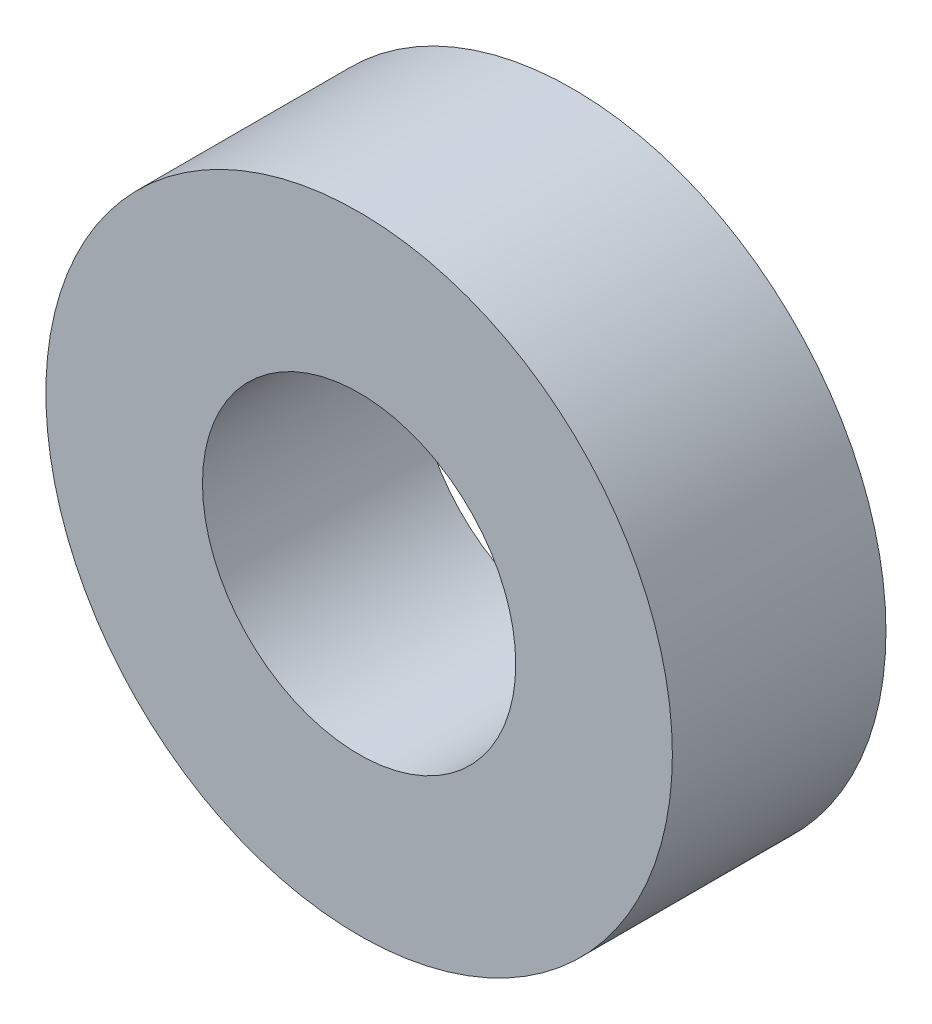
SolidWorks part; units mm, degrees
ref_plane "Front Plane" through (0, 0, 0) normal (0, 0, 1) x (1, 0, 0)
ref_plane "Top Plane" through (0, 0, 0) normal (0, 1, 0) x (1, 0, 0)
ref_plane "Right Plane" through (0, 0, 0) normal (1, 0, 0) x (0, 0, -1)
sketch "Sketch1" plane through (0, 0, 0) normal (0, 0, 1) x (1, 0, 0)
  circle A0 centre (0, 0) radius 69.85
  circle A1 centre (0, 0) radius 139.7
  dimension "D1" = 279.4
  dimension "D2" = 139.7
extrude "Boss-Extrude1" add sketch "Sketch1" along normal blind 95.25
